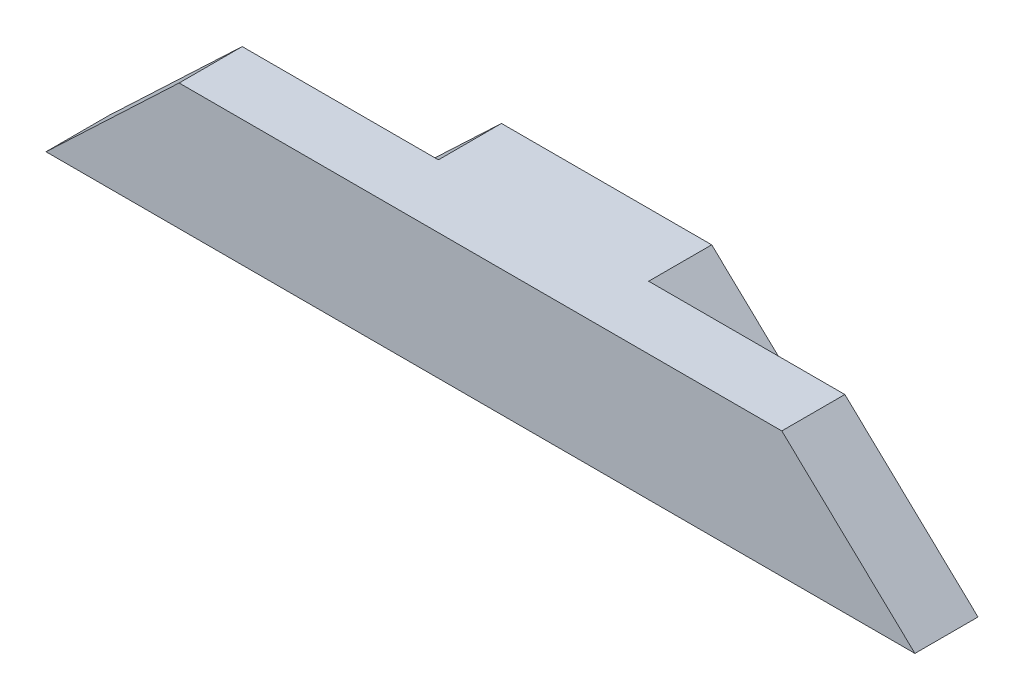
SolidWorks part; units mm, degrees
ref_plane "Plan de face" through (0, 0, 0) normal (0, 0, 1) x (1, 0, 0)
ref_plane "Plan de dessus" through (0, 0, 0) normal (0, 1, 0) x (1, 0, 0)
ref_plane "Plan de droite" through (0, 0, 0) normal (1, 0, 0) x (0, 0, -1)
sketch "Esquisse1" plane through (0, 0, 0) normal (0, 0, 1) x (1, 0, 0)
  line L1 (0, 0) -> (62, 0)
  line L2 (0, 0) -> (0, 9)
  line L3 (0, 9) -> (62, 9)
  line L4 (62, 0) -> (62, 9)
  dimension "D1" = 62
  dimension "D2" = 9
extrude "Extrusion1" add sketch "Esquisse1" along normal blind 9
sketch "Esquisse2" plane through (0, 0, 9) normal (0, 0, 1) x (1, 0, 0)
  line L0 (62, 9) -> (52.5, 9)
  line L1 (62, 9) -> (0, 9) construction
  line L2 (52.5, 9) -> (62, 0)
  line L3 (62, 0) -> (62, 9)
  line L4 (0, 9) -> (9.5, 9)
  line L5 (9.5, 9) -> (0, 0)
  line L6 (0, 0) -> (0, 9)
  dimension "D1" = 43
  dimension "D2" = 9.5
extrude "Enlèv. mat.-Extru.2" cut sketch "Esquisse2" against normal blind 9
sketch "Esquisse3" plane through (0, 0, 0) normal (0, 0, -1) x (-1, 0, 0)
  line L0 (-9.5, 9) -> (-23.5, 9)
  line L1 (-52.5, 9) -> (-9.5, 9) construction
  line L2 (-23.5, 9) -> (-14, 0)
  line L3 (0, 0) -> (-62, 0) construction
  line L4 (-14, 0) -> (0, 0)
  line L5 (0, 0) -> (-9.5, 9)
  line L6 (-52.5, 9) -> (-38.5, 9)
  line L7 (-38.5, 9) -> (-48, 0)
  line L8 (-48, 0) -> (-62, 0)
  line L9 (-62, 0) -> (-52.5, 9)
  dimension "D1" = 14
  dimension "D2" = 14
  dimension "D3" = 14
  dimension "D4" = 14
extrude "Enlèv. mat.-Extru.3" cut sketch "Esquisse3" against normal blind 4.5
